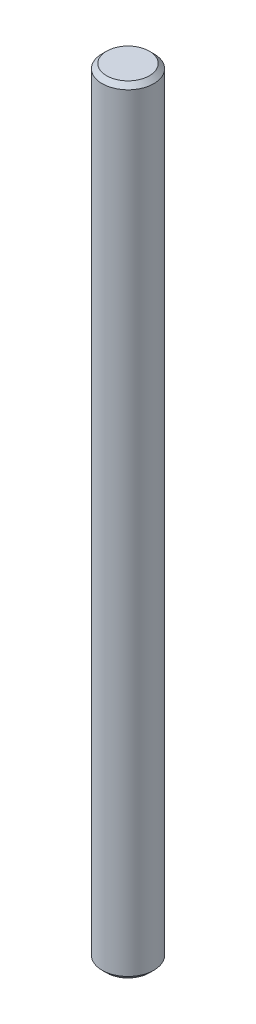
SolidWorks part; units mm, degrees
ref_plane "Front Plane" through (0, 0, 0) normal (0, 0, 1) x (1, 0, 0)
ref_plane "Top Plane" through (0, 0, 0) normal (0, 1, 0) x (1, 0, 0)
ref_plane "Right Plane" through (0, 0, 0) normal (1, 0, 0) x (0, 0, -1)
sketch "Sketch1" plane through (0, 0, 0) normal (0, 1, 0) x (1, 0, 0)
  circle A0 centre (0, 0) radius 2
  dimension "D1" = 4
extrude "Boss-Extrude1" add sketch "Sketch1" along normal blind 60
chamfer "Chamfer1" distance 0.35 angle 45 2 edges at (0, 0, 2) (0, 60, 2)
